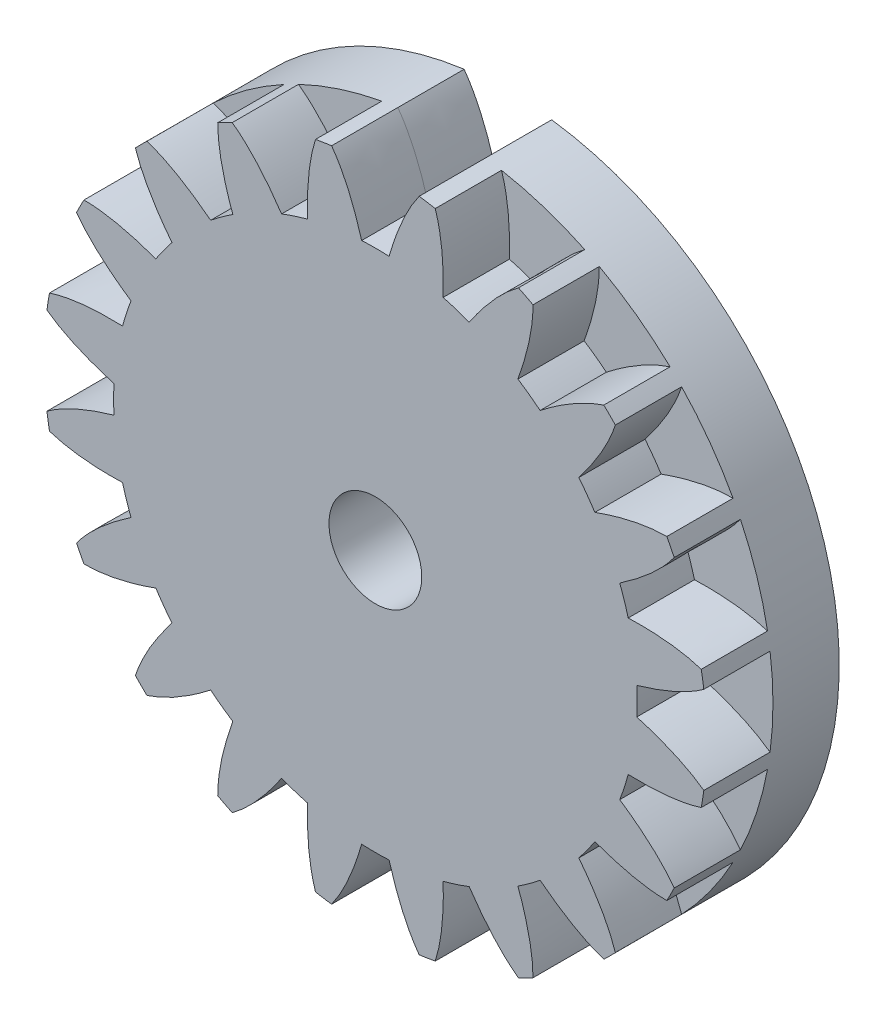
SolidWorks part; units mm, degrees
ref_plane "前基準面" through (0, 0, 0) normal (0, 0, 1) x (1, 0, 0)
ref_plane "上基準面" through (0, 0, 0) normal (0, 1, 0) x (1, 0, 0)
ref_plane "右基準面" through (0, 0, 0) normal (1, 0, 0) x (0, 0, -1)
sketch "草圖1" plane through (0, 0, 0) normal (0, 0, 1) x (1, 0, 0)
  line L0 (0, 0) -> (0, 50) construction
  line L1 (0, 0) -> (7.8217, 49.3844) construction
  line L2 (0, 0) -> (-7.8217, 49.3844) construction
  line L3 (0, 0) -> (-2.0673, 39.4459) construction
  line L4 (0, 0) -> (2.0673, 39.4459) construction
  line L5 (-6.6046, 49.5619) -> (-7.8217, 49.3844)
  line L6 (6.6046, 49.5619) -> (7.8217, 49.3844)
  circle A0 centre (0, 0) radius 7
  circle A1 centre (0, 0) radius 39.5
  circle A2 centre (0, 0) radius 45 construction
  circle A3 centre (0, 0) radius 50 construction
  spline S0 degree 2 poles (-2.0673, 39.4459) (-3.9394, 45.9074) (-6.6046, 49.5619) knots 0 0 0 1 1 1
  spline S1 degree 2 poles (2.0673, 39.4459) (3.9394, 45.9074) (6.6046, 49.5619) knots 0 0 0 1 1 1
  dimension "D1" = 100
  dimension "D2" = 90
  dimension "D3" = 79
  dimension "D4" = 14
  dimension "D5" = 18
  dimension "D6" = 6
  dimension "D7" = 1.23
sketch "草圖2" plane through (0, 0, 0) normal (0, 0, 1) x (1, 0, 0)
  line L0 (0, 63) -> (0, 45) construction
  line L1 (0, 63) -> (-6.8883, 46.3702) construction
  line L2 (0, 63) -> (6.8883, 46.3702) construction
  line L3 (0, 63) -> (-3.4455, 50.9842) construction
  line L4 (0, 63) -> (3.4455, 50.9842) construction
  line L5 (-1.625, 40) -> (1.625, 40)
  circle A0 centre (0, 63) radius 5
  circle A1 centre (0, 63) radius 12.5
  circle A2 centre (0, 63) radius 18 construction
  circle A3 centre (0, 0) radius 45 construction
  spline S0 degree 2 poles (-1.625, 40) (-3.9936, 45.6455) (-3.4455, 50.9842) knots 0 0 0 1 1 1
  spline S1 degree 2 poles (1.625, 40) (3.9936, 45.6455) (3.4455, 50.9842) knots 0 0 0 1 1 1
  point P14 (0, 40)
  dimension "D2" = 10
  dimension "D3" = 25
  dimension "D1" = 63
  dimension "D4" = 45
  dimension "D5" = 32
  dimension "D6" = 3.25
  dimension "D7" = 23
sketch "草圖3" plane through (0, 0, 0) normal (0, 0, 1) x (1, 0, 0)
  circle A0 centre (0, 0) radius 39.5 construction
  arc A1 (2.0673, 39.4459) -> (-2.0673, 39.4459) centre (0, 0) ccw
  arc A2 (14.1555, 36.8764) -> (10.2234, 38.1541) centre (0, 0) ccw
  arc A3 (24.8582, 30.6973) -> (21.5132, 33.1275) centre (0, 0) ccw
  arc A4 (33.1275, 21.5132) -> (30.6973, 24.8582) centre (0, 0) ccw
  arc A5 (38.1541, 10.2234) -> (36.8764, 14.1555) centre (0, 0) ccw
  arc A6 (39.4459, -2.0673) -> (39.4459, 2.0673) centre (0, 0) ccw
  arc A7 (36.8764, -14.1555) -> (38.1541, -10.2234) centre (0, 0) ccw
  arc A8 (30.6973, -24.8582) -> (33.1275, -21.5132) centre (0, 0) ccw
  arc A9 (21.5132, -33.1275) -> (24.8582, -30.6973) centre (0, 0) ccw
  arc A10 (10.2234, -38.1541) -> (14.1555, -36.8764) centre (0, 0) ccw
  arc A11 (-2.0673, -39.4459) -> (2.0673, -39.4459) centre (0, 0) ccw
  arc A12 (-14.1555, -36.8764) -> (-10.2234, -38.1541) centre (0, 0) ccw
  arc A13 (-24.8582, -30.6973) -> (-21.5132, -33.1275) centre (0, 0) ccw
  arc A14 (-33.1275, -21.5132) -> (-30.6973, -24.8582) centre (0, 0) ccw
  arc A15 (-38.1541, -10.2234) -> (-36.8764, -14.1555) centre (0, 0) ccw
  arc A16 (-39.4459, 2.0673) -> (-39.4459, -2.0673) centre (0, 0) ccw
  arc A17 (-36.8764, 14.1555) -> (-38.1541, 10.2234) centre (0, 0) ccw
  arc A18 (-30.6973, 24.8582) -> (-33.1275, 21.5132) centre (0, 0) ccw
  arc A19 (-21.5132, 33.1275) -> (-24.8582, 30.6973) centre (0, 0) ccw
  arc A20 (-10.2234, 38.1541) -> (-14.1555, 36.8764) centre (0, 0) ccw
  circle A21 centre (0, 0) radius 50 construction
  arc A22 (-6.6046, 49.5619) -> (-9.0341, 49.1771) centre (0, 0) ccw
  arc A23 (9.0341, 49.1771) -> (6.6046, 49.5619) centre (0, 0) ccw
  arc A24 (23.7885, 43.9785) -> (21.5968, 45.0952) centre (0, 0) ccw
  arc A25 (36.2143, 34.475) -> (34.475, 36.2143) centre (0, 0) ccw
  arc A26 (45.0952, 21.5968) -> (43.9785, 23.7885) centre (0, 0) ccw
  arc A27 (49.5619, 6.6046) -> (49.1771, 9.0341) centre (0, 0) ccw
  arc A28 (49.1771, -9.0341) -> (49.5619, -6.6046) centre (0, 0) ccw
  arc A29 (43.9785, -23.7885) -> (45.0952, -21.5968) centre (0, 0) ccw
  arc A30 (34.475, -36.2143) -> (36.2143, -34.475) centre (0, 0) ccw
  arc A31 (21.5968, -45.0952) -> (23.7885, -43.9785) centre (0, 0) ccw
  arc A32 (6.6046, -49.5619) -> (9.0341, -49.1771) centre (0, 0) ccw
  arc A33 (-9.0341, -49.1771) -> (-6.6046, -49.5619) centre (0, 0) ccw
  arc A34 (-23.7885, -43.9785) -> (-21.5968, -45.0952) centre (0, 0) ccw
  arc A35 (-36.2143, -34.475) -> (-34.475, -36.2143) centre (0, 0) ccw
  arc A36 (-45.0952, -21.5968) -> (-43.9785, -23.7885) centre (0, 0) ccw
  arc A37 (-49.5619, -6.6046) -> (-49.1771, -9.0341) centre (0, 0) ccw
  arc A38 (-49.1771, 9.0341) -> (-49.5619, 6.6046) centre (0, 0) ccw
  arc A39 (-43.9785, 23.7885) -> (-45.0952, 21.5968) centre (0, 0) ccw
  arc A40 (-34.475, 36.2143) -> (-36.2143, 34.475) centre (0, 0) ccw
  arc A41 (-21.5968, 45.0952) -> (-23.7885, 43.9785) centre (0, 0) ccw
  circle A42 centre (0, 0) radius 7 construction
  circle A43 centre (0, 0) radius 7
  parabola Q0 construction
  parabola Q1 construction
  parabola Q2
  parabola Q3
  parabola Q4
  parabola Q5
  parabola Q6
  parabola Q7
  parabola Q8
  parabola Q9
  parabola Q10
  parabola Q11
  parabola Q12
  parabola Q13
  parabola Q14
  parabola Q15
  parabola Q16
  parabola Q17
  parabola Q18
  parabola Q19
  parabola Q20
  parabola Q21
  parabola Q22
  parabola Q23
  parabola Q24
  parabola Q25
  parabola Q26
  parabola Q27
  parabola Q28
  parabola Q29
  parabola Q30
  parabola Q31
  parabola Q32
  parabola Q33
  parabola Q34
  parabola Q35
  parabola Q36
  parabola Q37
  parabola Q38
  parabola Q39
  parabola Q40
  parabola Q41
  point P169 (0, 0)
  dimension "D1" = 20
extrude "填料-伸長1" add sketch "草圖3" along normal blind 10
sketch "草圖4" plane through (0, 0, 0) normal (0, 0, 1) x (1, 0, 0)
  arc A0 (2.0673, 39.4459) -> (-2.0673, 39.4459) centre (0, 0) ccw construction
  arc A1 (2.0673, 39.4459) -> (-2.0673, 39.4459) centre (0, 0) ccw
  arc A2 (-6.6046, 49.5619) -> (6.6046, 49.5619) centre (0, 0) ccw
  circle A3 centre (0, 0) radius 7 construction
  circle A4 centre (0, 0) radius 7
  parabola Q15 construction
  parabola Q16 construction
  parabola Q17
  parabola Q18
extrude "填料-伸長2" add sketch "草圖4" against normal blind 10
sketch "草圖5" plane through (0, 0, 10) normal (0, 0, 1) x (1, 0, 0)
  arc A0 (-14.1555, 36.8764) -> (-21.5132, 33.1275) centre (0, 0) ccw
  arc A1 (-24.8582, 30.6973) -> (-30.6973, 24.8582) centre (0, 0) ccw
  arc A2 (-33.1275, 21.5132) -> (-36.8764, 14.1555) centre (0, 0) ccw
  arc A3 (-38.1541, 10.2234) -> (-39.4459, 2.0673) centre (0, 0) ccw
  arc A4 (-39.4459, -2.0673) -> (-38.1541, -10.2234) centre (0, 0) ccw
  arc A5 (-36.8764, -14.1555) -> (-33.1275, -21.5132) centre (0, 0) ccw
  arc A6 (-30.6973, -24.8582) -> (-24.8582, -30.6973) centre (0, 0) ccw
  arc A7 (-21.5132, -33.1275) -> (-14.1555, -36.8764) centre (0, 0) ccw
  arc A8 (-10.2234, -38.1541) -> (-2.0673, -39.4459) centre (0, 0) ccw
  arc A9 (2.0673, -39.4459) -> (10.2234, -38.1541) centre (0, 0) ccw
  arc A10 (14.1555, -36.8764) -> (21.5132, -33.1275) centre (0, 0) ccw
  arc A11 (24.8582, -30.6973) -> (30.6973, -24.8582) centre (0, 0) ccw
  arc A12 (33.1275, -21.5132) -> (36.8764, -14.1555) centre (0, 0) ccw
  arc A13 (38.1541, -10.2234) -> (39.4459, -2.0673) centre (0, 0) ccw
  arc A14 (39.4459, 2.0673) -> (38.1541, 10.2234) centre (0, 0) ccw
  arc A15 (36.8764, 14.1555) -> (33.1275, 21.5132) centre (0, 0) ccw
  arc A16 (30.6973, 24.8582) -> (24.8582, 30.6973) centre (0, 0) ccw
  arc A17 (21.5132, 33.1275) -> (14.1555, 36.8764) centre (0, 0) ccw
  arc A40 (2.0673, 39.4459) -> (-2.0673, 39.4459) centre (0, 0) ccw
  arc A41 (-6.6046, 49.5619) -> (-9.0341, 49.1771) centre (0, 0) ccw
  arc A42 (-10.2234, 38.1541) -> (-14.1555, 36.8764) centre (0, 0) ccw
  arc A43 (-21.5968, 45.0952) -> (-23.7885, 43.9785) centre (0, 0) ccw
  arc A44 (-21.5132, 33.1275) -> (-24.8582, 30.6973) centre (0, 0) ccw
  arc A45 (-34.475, 36.2143) -> (-36.2143, 34.475) centre (0, 0) ccw
  arc A46 (-30.6973, 24.8582) -> (-33.1275, 21.5132) centre (0, 0) ccw
  arc A47 (-43.9785, 23.7885) -> (-45.0952, 21.5968) centre (0, 0) ccw
  arc A48 (-36.8764, 14.1555) -> (-38.1541, 10.2234) centre (0, 0) ccw
  arc A49 (-49.1771, 9.0341) -> (-49.5619, 6.6046) centre (0, 0) ccw
  arc A50 (-39.4459, 2.0673) -> (-39.4459, -2.0673) centre (0, 0) ccw
  arc A51 (-49.5619, -6.6046) -> (-49.1771, -9.0341) centre (0, 0) ccw
  arc A52 (-38.1541, -10.2234) -> (-36.8764, -14.1555) centre (0, 0) ccw
  arc A53 (-45.0952, -21.5968) -> (-43.9785, -23.7885) centre (0, 0) ccw
  arc A54 (-33.1275, -21.5132) -> (-30.6973, -24.8582) centre (0, 0) ccw
  arc A55 (-36.2143, -34.475) -> (-34.475, -36.2143) centre (0, 0) ccw
  arc A56 (-24.8582, -30.6973) -> (-21.5132, -33.1275) centre (0, 0) ccw
  arc A57 (-23.7885, -43.9785) -> (-21.5968, -45.0952) centre (0, 0) ccw
  arc A58 (-14.1555, -36.8764) -> (-10.2234, -38.1541) centre (0, 0) ccw
  arc A59 (-9.0341, -49.1771) -> (-6.6046, -49.5619) centre (0, 0) ccw
  arc A60 (-2.0673, -39.4459) -> (2.0673, -39.4459) centre (0, 0) ccw
  arc A61 (6.6046, -49.5619) -> (9.0341, -49.1771) centre (0, 0) ccw
  arc A62 (10.2234, -38.1541) -> (14.1555, -36.8764) centre (0, 0) ccw
  arc A63 (21.5968, -45.0952) -> (23.7885, -43.9785) centre (0, 0) ccw
  arc A64 (21.5132, -33.1275) -> (24.8582, -30.6973) centre (0, 0) ccw
  arc A65 (34.475, -36.2143) -> (36.2143, -34.475) centre (0, 0) ccw
  arc A66 (30.6973, -24.8582) -> (33.1275, -21.5132) centre (0, 0) ccw
  arc A67 (43.9785, -23.7885) -> (45.0952, -21.5968) centre (0, 0) ccw
  arc A68 (36.8764, -14.1555) -> (38.1541, -10.2234) centre (0, 0) ccw
  arc A69 (49.1771, -9.0341) -> (49.5619, -6.6046) centre (0, 0) ccw
  arc A70 (39.4459, -2.0673) -> (39.4459, 2.0673) centre (0, 0) ccw
  arc A71 (49.5619, 6.6046) -> (49.1771, 9.0341) centre (0, 0) ccw
  arc A72 (38.1541, 10.2234) -> (36.8764, 14.1555) centre (0, 0) ccw
  arc A73 (45.0952, 21.5968) -> (43.9785, 23.7885) centre (0, 0) ccw
  arc A74 (33.1275, 21.5132) -> (30.6973, 24.8582) centre (0, 0) ccw
  arc A75 (36.2143, 34.475) -> (34.475, 36.2143) centre (0, 0) ccw
  arc A76 (24.8582, 30.6973) -> (21.5132, 33.1275) centre (0, 0) ccw
  arc A77 (23.7885, 43.9785) -> (21.5968, 45.0952) centre (0, 0) ccw
  arc A78 (14.1555, 36.8764) -> (10.2234, 38.1541) centre (0, 0) ccw
  arc A79 (9.0341, 49.1771) -> (6.6046, 49.5619) centre (0, 0) ccw
  arc A83 (-21.5968, 45.0952) -> (-23.7885, 43.9785) centre (0, 0) ccw
  arc A85 (-34.475, 36.2143) -> (-36.2143, 34.475) centre (0, 0) ccw
  arc A87 (-43.9785, 23.7885) -> (-45.0952, 21.5968) centre (0, 0) ccw
  arc A89 (-49.1771, 9.0341) -> (-49.5619, 6.6046) centre (0, 0) ccw
  arc A90 (-39.4459, 2.0673) -> (-39.4459, -2.0673) centre (0, 0) ccw
  arc A91 (-49.5619, -6.6046) -> (-49.1771, -9.0341) centre (0, 0) ccw
  arc A93 (-45.0952, -21.5968) -> (-43.9785, -23.7885) centre (0, 0) ccw
  arc A95 (-36.2143, -34.475) -> (-34.475, -36.2143) centre (0, 0) ccw
  arc A97 (-23.7885, -43.9785) -> (-21.5968, -45.0952) centre (0, 0) ccw
  arc A99 (-9.0341, -49.1771) -> (-6.6046, -49.5619) centre (0, 0) ccw
  arc A101 (6.6046, -49.5619) -> (9.0341, -49.1771) centre (0, 0) ccw
  arc A103 (21.5968, -45.0952) -> (23.7885, -43.9785) centre (0, 0) ccw
  arc A105 (34.475, -36.2143) -> (36.2143, -34.475) centre (0, 0) ccw
  arc A107 (43.9785, -23.7885) -> (45.0952, -21.5968) centre (0, 0) ccw
  arc A109 (49.1771, -9.0341) -> (49.5619, -6.6046) centre (0, 0) ccw
  arc A111 (49.5619, 6.6046) -> (49.1771, 9.0341) centre (0, 0) ccw
  arc A113 (45.0952, 21.5968) -> (43.9785, 23.7885) centre (0, 0) ccw
  arc A115 (36.2143, 34.475) -> (34.475, 36.2143) centre (0, 0) ccw
  arc A117 (23.7885, 43.9785) -> (21.5968, 45.0952) centre (0, 0) ccw
  parabola Q40
  parabola Q41
  parabola Q42
  parabola Q43
  parabola Q44
  parabola Q45
  parabola Q46
  parabola Q47
  parabola Q48
  parabola Q49
  parabola Q50
  parabola Q51
  parabola Q52
  parabola Q53
  parabola Q54
  parabola Q55
  parabola Q56
  parabola Q57
  parabola Q58
  parabola Q59
  parabola Q60
  parabola Q61
  parabola Q62
  parabola Q63
  parabola Q64
  parabola Q65
  parabola Q66
  parabola Q67
  parabola Q68
  parabola Q69
  parabola Q70
  parabola Q71
  parabola Q72
  parabola Q73
  parabola Q74
  parabola Q75
  parabola Q76
  parabola Q77
  parabola Q78
  parabola Q79
  parabola Q83
  parabola Q84
  parabola Q85
  parabola Q86
  parabola Q87
  parabola Q88
  parabola Q89
  parabola Q90
  parabola Q91
  parabola Q92
  parabola Q93
  parabola Q94
  parabola Q95
  parabola Q96
  parabola Q97
  parabola Q98
  parabola Q99
  parabola Q100
  parabola Q101
  parabola Q102
  parabola Q103
  parabola Q104
  parabola Q105
  parabola Q106
  parabola Q107
  parabola Q108
  parabola Q109
  parabola Q110
  parabola Q111
  parabola Q112
  parabola Q113
  parabola Q114
  parabola Q115
  parabola Q116
  parabola Q117
  parabola Q118
  dimension "D1" = 0
